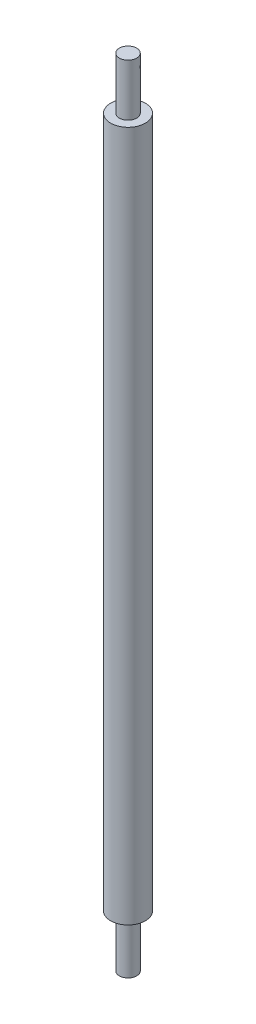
SolidWorks part; units mm, degrees
ref_plane "Front Plane" through (0, 0, 0) normal (0, 0, 1) x (1, 0, 0)
ref_plane "Top Plane" through (0, 0, 0) normal (0, 1, 0) x (1, 0, 0)
ref_plane "Right Plane" through (0, 0, 0) normal (1, 0, 0) x (0, 0, -1)
sketch "Sketch1" plane through (0, 0, 0) normal (0, 1, 0) x (1, 0, 0)
  circle A0 centre (0, 0) radius 3
  dimension "D1" = 6
extrude "Extrude1" add sketch "Sketch1" along normal blind 119.5
sketch "Sketch2" plane through (0, 119.5, 0) normal (0, 1, 0) x (1, 0, 0)
  circle A0 centre (0, 0) radius 1.5
  dimension "D1" = 3
extrude "Extrude2" add sketch "Sketch2" along normal blind 9
sketch "Sketch3" plane through (0, 0, 0) normal (0, -1, 0) x (1, 0, 0)
  circle A0 centre (0, 0) radius 1.5
  dimension "D1" = 3
extrude "Extrude3" add sketch "Sketch3" along normal blind 9
